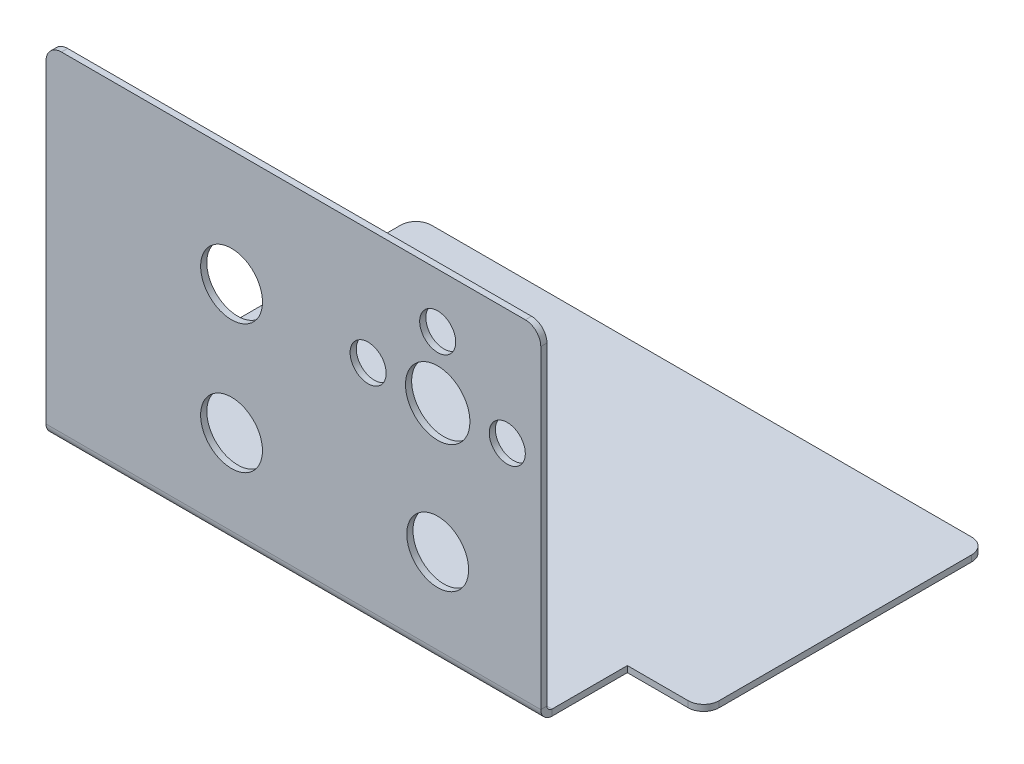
SolidWorks part; units mm, degrees
other "<Усилитель петли короба>-<Вырез-Вытянуть5>"
ref_plane "Plane1" through (0, 0, 0) normal (0, 0, 1) x (1, 0, 0)
ref_plane "Plane2" through (0, 0, 0) normal (0, 1, 0) x (1, 0, 0)
ref_plane "Plane3" through (0, 0, 0) normal (1, 0, 0) x (0, 0, -1)
mirrored part "Усилитель петли короба_Зеркально отражен"
sketch "Эскиз1" plane through (0, 0, 1.2) normal (0, 0, 1) x (1, 0, 0)
  line L0 (0, -1.2) -> (-96, -1.2) construction
  line L1 (-91, -1.2) -> (-50.5, -1.2)
  line L2 (-91, -1.2) -> (-91, 1)
  line L3 (-91, 1) -> (-50.5, 1)
  line L4 (-50.5, -1.2) -> (-50.5, 1)
  line L5 (0, 1) -> (-96, 1) construction
  line L6 (-96, -1.2) -> (-91, -1.2) construction
  line L7 (-5, 1) -> (-45.5, 1)
  line L8 (-5, 1) -> (-5, -1.2)
  line L9 (-5, -1.2) -> (-45.5, -1.2)
  line L10 (-45.5, 1) -> (-45.5, -1.2)
  line L11 (-5, -1.2) -> (0, -1.2) construction
  line L12 (-45.5, -1.2) -> (-50.5, -1.2) construction
  dimension "D1" = 5
extrude "Вырез-Вытянуть1" [suppressed] cut sketch "Эскиз1" against normal up to vertex
